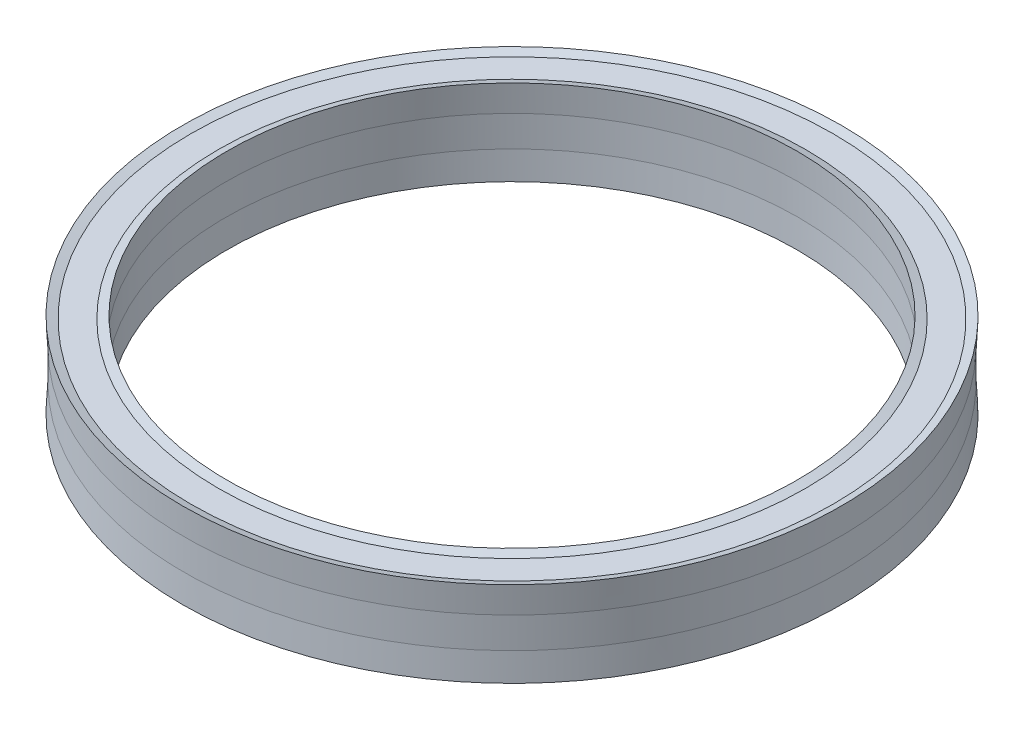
SolidWorks part; units mm, degrees
ref_plane "Front Plane" through (0, 0, 0) normal (0, 0, 1) x (1, 0, 0)
ref_plane "Top Plane" through (0, 0, 0) normal (0, 1, 0) x (1, 0, 0)
ref_plane "Right Plane" through (0, 0, 0) normal (1, 0, 0) x (0, 0, -1)
sketch "Sketch1" plane through (0, 0, 0) normal (0, 0, 1) x (1, 0, 0)
  line L0 (12.7, 3.81) -> (12.7635, 2.5908)
  line L1 (12.7635, 2.5908) -> (12.7635, 1.2192)
  line L2 (12.7635, 1.2192) -> (12.7, 0)
  line L3 (13.081, 0.127) -> (12.7, 0)
  line L5 (13.081, 0.127) -> (14.3034, 0.127)
  line L6 (12.7, 3.81) -> (13.081, 3.683)
  line L7 (13.081, 3.683) -> (14.3034, 3.683)
  line L8 (13.6922, 3.683) -> (13.6922, 0.127) construction
  line L9 (0, 0) -> (0, 12.3922) construction
  line L10 (14.6844, 3.81) -> (14.3034, 3.683)
  line L11 (14.6844, 0) -> (14.3034, 0.127)
  line L13 (14.6209, 1.2192) -> (14.6844, 0)
  line L14 (14.6209, 2.5908) -> (14.6209, 1.2192)
  line L15 (14.6844, 3.81) -> (14.6209, 2.5908)
  line L16 (12.7635, 1.905) -> (22.0355, 1.905) construction
  dimension "D1" = 25.4
  dimension "D2" = 25.527
  dimension "D3" = 3.81
  dimension "D4" = 1.2192
  dimension "D5" = 0.127
  dimension "D6" = 0.381
  dimension "D7" = 29.3687
revolve "Revolve1" add sketch "Sketch1" angle 360 about L9
